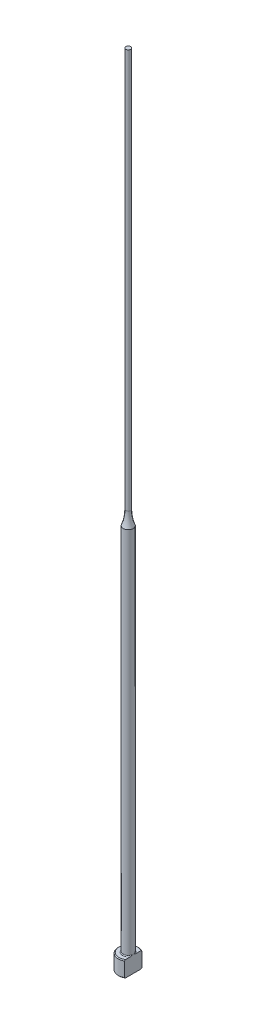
SolidWorks part; units mm, degrees
ref_plane "Front Plane" through (0, 0, 0) normal (0, 0, 1) x (1, 0, 0)
ref_plane "Top Plane" through (0, 0, 0) normal (0, 1, 0) x (1, 0, 0)
ref_plane "Right Plane" through (0, 0, 0) normal (1, 0, 0) x (0, 0, -1)
sketch "Sketch1" plane through (0, 0, 0) normal (0, 0, 1) x (1, 0, 0)
  line L0 (0, 259.9588) -> (0, -15.1925) construction
  line L1 (0, 0) -> (-2.5, 0)
  line L2 (-2.5, 0) -> (-2.5, 4)
  line L3 (-2.5, 4) -> (-1.25, 4)
  line L4 (-0.6, 100) -> (-0.6, 200)
  line L5 (-0.6, 200) -> (0, 200)
  line L6 (0, 200) -> (0, 0)
  line L7 (-1.25, 4) -> (-1.25, 96.4535)
  arc A0 (-1.25, 96.4535) -> (-0.6, 100) centre (-10.6, 100) ccw
  point P13 (-1.25, 0)
  dimension "D1" = 10
  dimension "L" = 200
  dimension "H" = 5
  dimension "T" = 4
  dimension "D" = 1.2
  dimension "B" = 2.5
  dimension "S" = 100
revolve "Revolve1" add sketch "Sketch1" angle 360 about L0
chamfer "Chamfer1" distance 0.2 angle 45 2 edges at (0, 4, 2.5) (0, 0, 2.5)
fillet "Fillet1" radius 0.2 1 edges at (0, 4, 1.25)
sketch "Sketch2" plane through (0, 0, 0) normal (0, 1, 0) x (1, 0, 0)
  line L0 (1.25, -2.1651) -> (1.25, 2.1651)
  circle A0 centre (0, 0) radius 2.5 construction
  arc A1 (1.25, -2.1651) -> (1.25, 2.1651) centre (0, 0) ccw
  circle A2 centre (0, 0) radius 1.25 construction
extrude "Keyed Head" cut sketch "Sketch2" along normal through all
